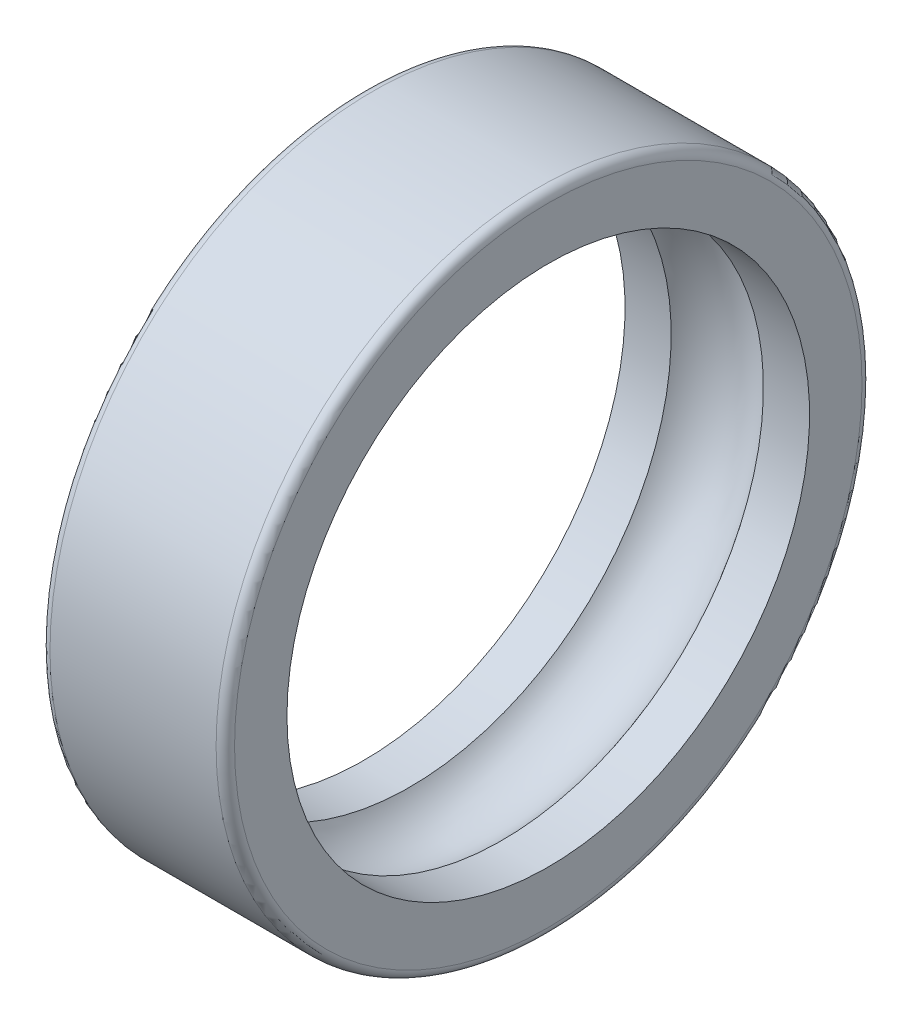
SolidWorks part; units mm, degrees
ref_plane "Plan de face" through (0, 0, 0) normal (0, 0, 1) x (1, 0, 0)
ref_plane "Plan de dessus" through (0, 0, 0) normal (0, 1, 0) x (1, 0, 0)
ref_plane "Plan de droite" through (0, 0, 0) normal (1, 0, 0) x (0, 0, -1)
sketch "Esquisse1" plane through (0, 0, 0) normal (0, 0, 1) x (1, 0, 0)
  line L0 (0, 13.6) -> (0, 11.328)
  line L1 (0, 11.328) -> (2.0009, 11.328)
  line L2 (5.9991, 11.328) -> (8, 11.328)
  line L3 (8, 11.328) -> (8, 13.6)
  line L4 (7.6, 14) -> (0.4, 14)
  line L5 (8, 0) -> (0, 0) construction
  arc A0 (2.0009, 11.328) -> (5.9991, 11.328) centre (4, 10) cw
  arc A1 (8, 13.6) -> (7.6, 14) centre (7.6, 13.6) ccw
  arc A2 (0.4, 14) -> (0, 13.6) centre (0.4, 13.6) ccw
revolve "Révolution1" add sketch "Esquisse1" angle 360 about L5
